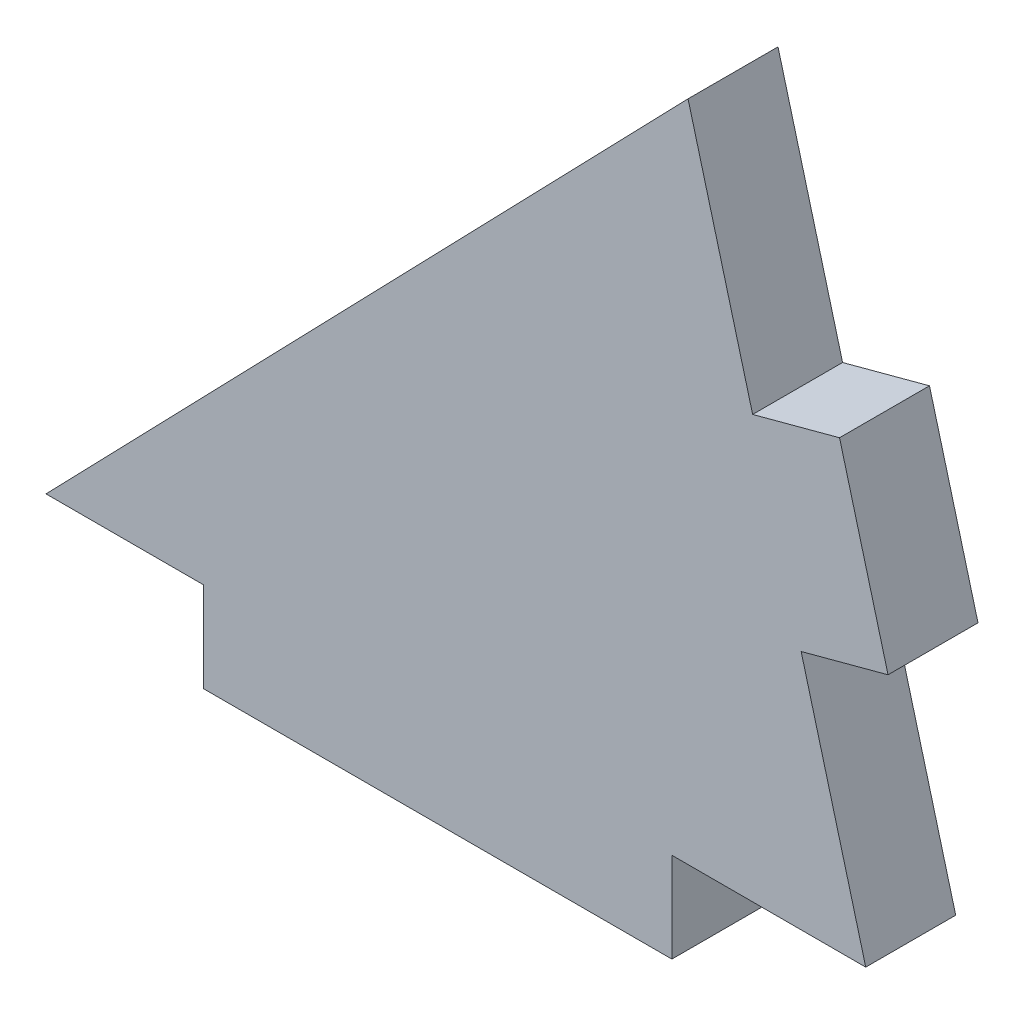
SolidWorks part; units mm, degrees
ref_plane "Front Plane" through (0, 0, 0) normal (0, 0, 1) x (1, 0, 0)
ref_plane "Top Plane" through (0, 0, 0) normal (0, 1, 0) x (1, 0, 0)
ref_plane "Right Plane" through (0, 0, 0) normal (1, 0, 0) x (0, 0, -1)
sketch "Sketch1" plane through (0, 0, 0) normal (0, 0, 1) x (1, 0, 0)
  line L0 (18.2285, 0) -> (18.2285, -1.524)
  line L1 (18.2285, -1.524) -> (26.166, -1.524)
  line L2 (26.166, -1.524) -> (18.2285, -1.524) construction
  line L3 (26.166, -1.524) -> (26.166, 0)
  line L4 (26.166, 0) -> (29.4501, 0)
  line L5 (29.4501, 0) -> (28.3558, 4.084)
  line L6 (18.2285, 0) -> (15.5632, 0)
  line L7 (15.5632, 0) -> (26.4397, 11.2348)
  line L8 (27.534, 7.1508) -> (26.4397, 11.2348)
  line L9 (28.3558, 4.084) -> (29.8279, 4.4785)
  line L10 (27.534, 7.1508) -> (29.0061, 7.5453)
  line L12 (29.8279, 4.4785) -> (29.0061, 7.5453)
extrude "Boss-Extrude1" add sketch "Sketch1" along normal blind 1.524
